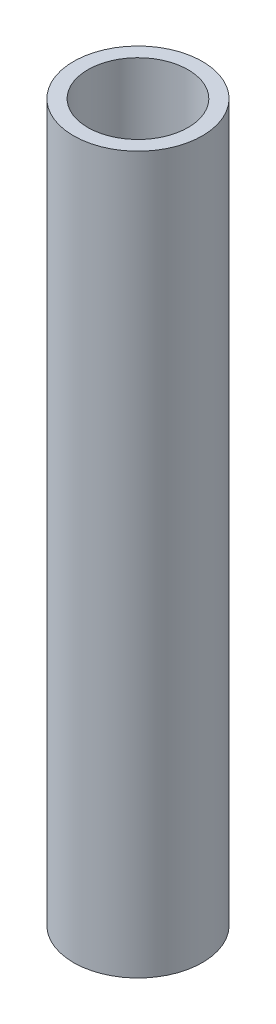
SolidWorks part; units mm, degrees
ref_plane "Front Plane" through (0, 0, 0) normal (0, 0, 1) x (1, 0, 0)
ref_plane "Top Plane" through (0, 0, 0) normal (0, 1, 0) x (1, 0, 0)
ref_plane "Right Plane" through (0, 0, 0) normal (1, 0, 0) x (0, 0, -1)
sketch "Sketch1" plane through (0, 0, 0) normal (0, 1, 0) x (1, 0, 0)
  circle A0 centre (0, 0) radius 4.5
  circle A1 centre (0, 0) radius 3.5
  dimension "D1" = 7
  dimension "D2" = 9
extrude "Boss-Extrude1" add sketch "Sketch1" along normal blind 50
